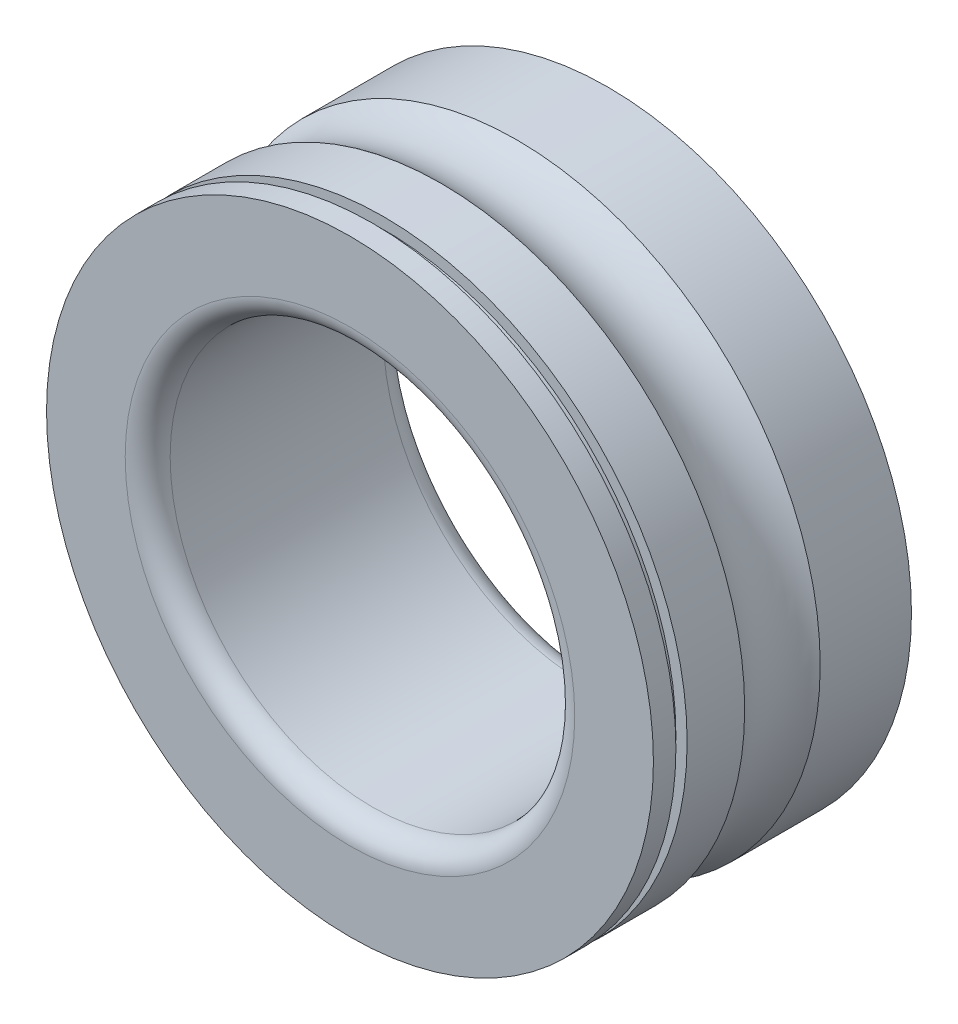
SolidWorks part; units mm, degrees
ref_plane "Plan1" through (0, 0, 0) normal (0, 0, 1) x (1, 0, 0)
ref_plane "Plan2" through (0, 0, 0) normal (0, 1, 0) x (1, 0, 0)
ref_plane "Plan3" through (0, 0, 0) normal (1, 0, 0) x (0, 0, -1)
sketch "Esquisse1" plane through (0, 0, 0) normal (1, 0, 0) x (0, 0, -1)
  line L0 (-2.87, 6.75) -> (-2.37, 6.75)
  line L1 (-2.87, 6.75) -> (-2.87, 5)
  line L2 (2.37, 4.5) -> (-2.37, 4.5)
  line L3 (2.87, 5) -> (2.87, 6.75)
  line L4 (0, 19) -> (0, -9) construction
  line L5 (0, 0) -> (-10, 0) construction
  line L6 (-2.37, 6.75) -> (-2.37, 6.5)
  line L7 (-2.37, 6.5) -> (-2.12, 6.5)
  line L8 (0.84, 6.75) -> (2.87, 6.75)
  line L9 (-2.12, 6.5) -> (-2.12, 6.75)
  line L10 (-2.12, 6.75) -> (-0.84, 6.75)
  arc A0 (-0.84, 6.75) -> (0.84, 6.75) centre (0, 7.87) ccw
  arc A1 (2.87, 5) -> (2.37, 4.5) centre (2.37, 5) cw
  arc A2 (-2.87, 5) -> (-2.37, 4.5) centre (-2.37, 5) ccw
  point P16 (2.87, 4.5)
  point P19 (-2.87, 4.5)
  dimension "D8" = 0.5
  dimension "D9" = 0.25
  dimension "D1" = 2.25
  dimension "D3" = 1.12
  dimension "D4" = 1.4
  dimension "D2" = 4.5
  dimension "D5" = 5.74
  dimension "D6" = 0.5
  dimension "D7" = 0.25
  dimension "D10" = 2.87
revolve "Base-Révolution" add sketch "Esquisse1" angle 360 about L5
